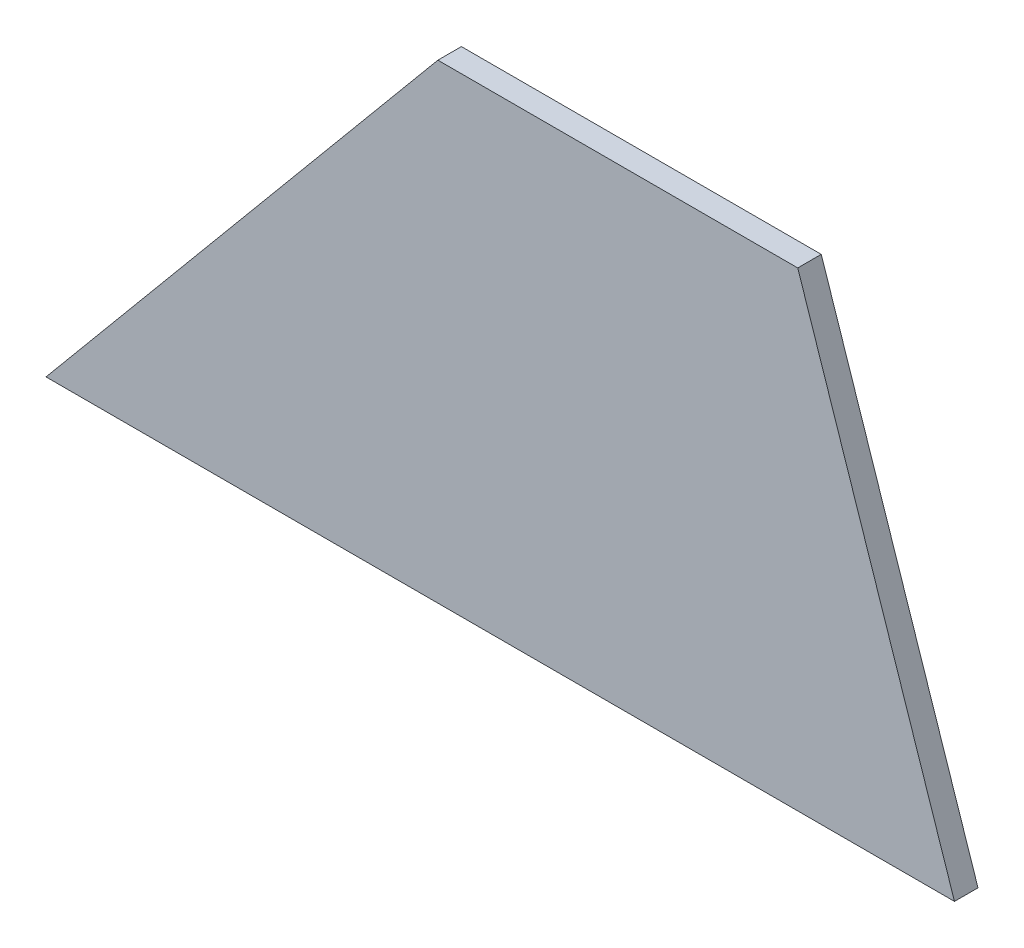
SolidWorks part; units mm, degrees
ref_plane "Front Plane" through (0, 0, 0) normal (0, 0, 1) x (1, 0, 0)
ref_plane "Top Plane" through (0, 0, 0) normal (0, 1, 0) x (1, 0, 0)
ref_plane "Right Plane" through (0, 0, 0) normal (1, 0, 0) x (0, 0, -1)
sketch "Sketch4" plane through (0, 0, 0) normal (0, 0, 1) x (1, 0, 0)
  line L0 (63.7537, 187.354) -> (122.0642, 187.354)
  line L1 (0.2537, 111.154) -> (147.4642, 111.154)
  line L2 (122.0642, 187.354) -> (147.4642, 111.154)
  line L3 (63.7537, 187.354) -> (0.2537, 111.154)
extrude "Extrude1" add sketch "Sketch4" along normal blind 3.81
